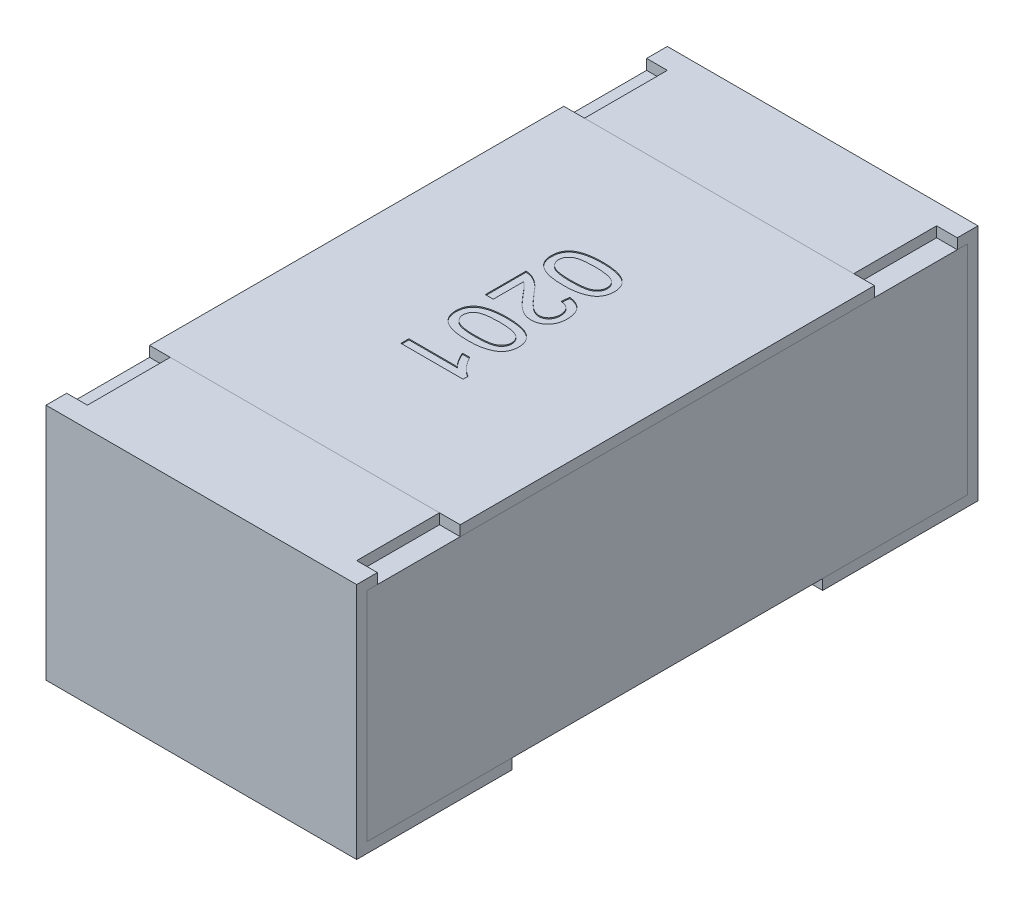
SolidWorks part; units mm, degrees
ref_plane "Front Plane" through (0, 0, 0) normal (0, 0, 1) x (1, 0, 0)
ref_plane "Top Plane" through (0, 0, 0) normal (0, 1, 0) x (1, 0, 0)
ref_plane "Right Plane" through (0, 0, 0) normal (1, 0, 0) x (0, 0, -1)
sketch "Sketch4" plane through (0, 0, 0) normal (1, 0, 0) x (0, 0, -1)
  line L0 (0, 0.1169) -> (0, -0.0721) construction
  line L1 (-0.3, 0) -> (0.3788, 0) construction
  line L2 (-0.3, 0.115) -> (-0.3, -0.115)
  line L3 (-0.3, -0.115) -> (-0.15, -0.115)
  line L4 (-0.2, 0.115) -> (-0.2, 0.105)
  line L5 (-0.2, 0.105) -> (-0.29, 0.105)
  line L6 (-0.29, 0.105) -> (-0.29, -0.105)
  line L7 (-0.29, -0.105) -> (-0.15, -0.105)
  line L8 (-0.15, -0.105) -> (-0.15, -0.115)
  line L9 (-0.2, 0.115) -> (-0.3, 0.115)
  line L10 (0.2, 0.115) -> (0.3, 0.115)
  line L11 (0.15, -0.105) -> (0.15, -0.115)
  line L12 (0.29, -0.105) -> (0.15, -0.105)
  line L13 (0.29, 0.105) -> (0.29, -0.105)
  line L14 (0.2, 0.105) -> (0.29, 0.105)
  line L15 (0.2, 0.115) -> (0.2, 0.105)
  line L16 (0.3, -0.115) -> (0.15, -0.115)
  line L17 (0.3, 0.115) -> (0.3, -0.115)
  dimension "LENGTH" = 0.3
  dimension "HEIGHT" = 0.23
  dimension "END CAP TOP LENGTH" = 0.1
  dimension "END CAP BOTTOM LENGTH" = 0.15
  dimension "D5" = 0.01
  dimension "D6" = 0.01
extrude "Boss-Extrude2" add sketch "Sketch4" along normal mid plane 0.3
sketch "Sketch5" plane through (0, 0, 0) normal (1, 0, 0) x (0, 0, -1)
  line L1 (-0.29, 0.105) -> (0.29, 0.105)
  line L2 (-0.29, 0.105) -> (-0.29, -0.105)
  line L3 (-0.29, -0.105) -> (0.29, -0.105)
  line L4 (0.29, 0.105) -> (0.29, -0.105)
extrude "Boss-Extrude3" add sketch "Sketch5" along normal up to surface and the other way up to surface separate body
sketch "Sketch6" plane through (0, 0.115, 0) normal (0, 1, 0) x (1, 0, 0)
  line L0 (-0.15, 0.3) -> (-0.15, 0.2) construction
  line L1 (-0.15, 0.28) -> (-0.13, 0.28)
  line L2 (-0.15, 0.28) -> (-0.15, 0.2)
  line L3 (-0.15, 0.2) -> (-0.13, 0.2)
  line L4 (-0.13, 0.28) -> (-0.13, 0.2)
  line L5 (0.15, 0.2) -> (-0.15, 0.2) construction
  line L6 (0, 0.0345) -> (0, -0.0345) construction
  line L7 (-0.0325, 0) -> (0.03, 0) construction
  line L8 (0.15, 0.28) -> (0.15, 0.2)
  line L9 (0.15, 0.2) -> (0.13, 0.2)
  line L10 (0.13, 0.28) -> (0.13, 0.2)
  line L11 (0.15, 0.28) -> (0.13, 0.28)
  line L12 (0.15, -0.28) -> (0.13, -0.28)
  line L13 (0.15, -0.28) -> (0.15, -0.2)
  line L14 (0.15, -0.2) -> (0.13, -0.2)
  line L15 (0.13, -0.28) -> (0.13, -0.2)
  line L16 (-0.15, -0.28) -> (-0.13, -0.28)
  line L17 (-0.15, -0.28) -> (-0.15, -0.2)
  line L18 (-0.15, -0.2) -> (-0.13, -0.2)
  line L19 (-0.13, -0.28) -> (-0.13, -0.2)
  dimension "TOP CUT WIDTH" = 0.02
  dimension "TOP CUT LENGTH" = 0.08
extrude "Cut-Extrude1" cut sketch "Sketch6" against normal up to surface (0.01 mm away)
sketch "Sketch7" plane through (0, 0.105, 0) normal (0, 1, 0) x (1, 0, 0)
  line L1 (-0.15, 0.2) -> (0.15, 0.2)
  line L2 (-0.15, 0.2) -> (-0.15, -0.2)
  line L3 (-0.15, -0.2) -> (0.15, -0.2)
  line L4 (0.15, 0.2) -> (0.15, -0.2)
  line L5 (0.13, -0.2) -> (-0.13, -0.2) construction
  line L6 (0.13, 0.2) -> (-0.13, 0.2) construction
  line L7 (-0.15, -0.29) -> (-0.15, 0.29) construction
  line L8 (0.15, 0.29) -> (0.15, -0.29) construction
extrude "Boss-Extrude4" add sketch "Sketch7" along normal up to surface (0.01 mm away) separate body
sketch "PART NUMBER" plane through (0, 0.115, 0) normal (0, 1, 0) x (1, 0, 0)
  line L0 (-0.0246, 0.1) -> (-0.0246, -0.1) construction
  line L1 (0, 0) -> (-0.0246, 0) construction
  text T0 "01005" font "Arial" height 0.05
  dimension "D1" = 0.2
sketch "Sketch8" plane through (0, 0.115, 0) normal (0, 1, 0) x (1, 0, 0)
  line L0 (-0.0304, 0.1057) -> (-0.0304, -0.1057) construction
  line L1 (0, 0) -> (-0.0304, 0) construction
  text T0 "0201" font "Arial" height 0.06
extrude "TEXT0201" cut sketch "Sketch8" against normal blind 0.001
sketch "Sketch9" plane through (0, 0.115, 0) normal (0, 1, 0) x (1, 0, 0)
  line L0 (-0.0372, 0.139) -> (-0.0372, -0.139) construction
  line L1 (-0.0372, 0) -> (0, 0) construction
  text T0 "0402" font "Arial" height 0.08
sketch "Sketch10" plane through (0, 0.115, 0) normal (0, 1, 0) x (1, 0, 0)
  line L0 (-0.125, 0.425) -> (-0.125, -0.425) construction
  line L1 (0, 0) -> (-0.125, 0) construction
  text T0 "0603" font "Arial" height 0.25
  dimension "D1" = 0.125
  dimension "D2" = 0.85
sketch "Sketch11" plane through (0, 0.115, 0) normal (0, 1, 0) x (1, 0, 0)
  line L0 (0, 0) -> (-0.15, 0) construction
  line L1 (-0.15, 0.515) -> (-0.15, -0.515) construction
  text T0 "0805" font "Arial" height 0.3
  dimension "D1" = 0.15
sketch "Sketch12" plane through (0, 0.115, 0) normal (0, 1, 0) x (1, 0, 0)
  line L0 (-0.15, 0.5423) -> (-0.15, -0.5423) construction
  line L1 (0, 0) -> (-0.15, 0) construction
  text T0 "1206" font "Arial" height 0.3
  dimension "D1" = 0.15
sketch "Sketch13" plane through (0, 0.115, 0) normal (0, 1, 0) x (1, 0, 0)
  line L0 (-0.15, 0.5735) -> (-0.15, -0.5735) construction
  line L1 (0, 0) -> (-0.15, 0) construction
  text T0 "1210" font "Arial" height 0.3
  dimension "D1" = 0.15
sketch "Sketch14" plane through (0, 0.115, 0) normal (0, 1, 0) x (1, 0, 0)
  line L0 (-0.25, 0.8778) -> (-0.25, -0.8778) construction
  line L1 (0, 0) -> (-0.25, 0) construction
  text T0 "1812" font "Arial" height 0.5
  dimension "D1" = 0.25
sketch "Sketch15" plane through (0, 0.115, 0) normal (0, 1, 0) x (1, 0, 0)
  line L0 (-0.25, 0.9382) -> (-0.25, -0.9382) construction
  line L1 (0, 0) -> (-0.25, 0) construction
  text T0 "2010" font "Arial" height 0.5
  dimension "D1" = 0.25
sketch "Sketch16" plane through (0, 0.115, 0) normal (0, 1, 0) x (1, 0, 0)
  line L0 (-0.25, 1.4279) -> (-0.25, -1.4279) construction
  line L1 (0, 0) -> (-0.25, 0) construction
  text T0 "2512" font "Arial" height 0.5
  dimension "D1" = 0.25
